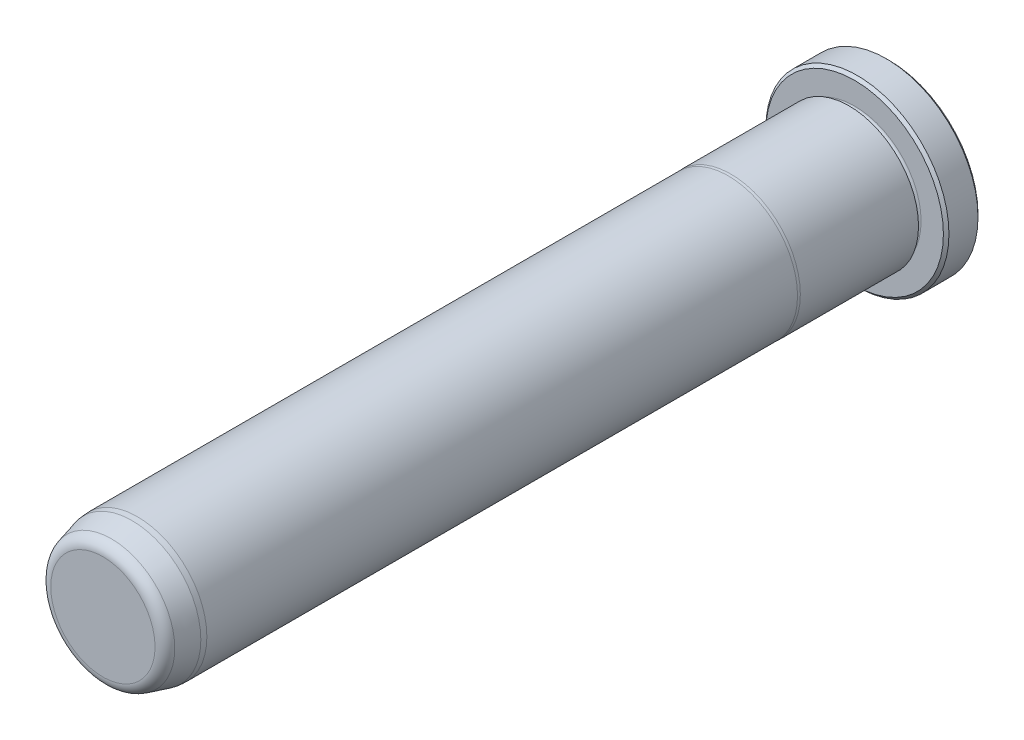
SolidWorks part; units mm, degrees
ref_plane "Front Plane" through (0, 0, 0) normal (0, 0, 1) x (1, 0, 0)
ref_plane "Top Plane" through (0, 0, 0) normal (0, 1, 0) x (1, 0, 0)
ref_plane "Right Plane" through (0, 0, 0) normal (1, 0, 0) x (0, 0, -1)
sketch "Sketch1" plane through (0, 0, 0) normal (1, 0, 0) x (0, 0, -1)
  line L0 (0, 0) -> (0, 12.573)
  line L1 (0, 12.573) -> (-4.7498, 12.573)
  line L2 (-4.7498, 12.573) -> (-4.7498, 9.1313)
  line L3 (-4.7498, 8.7503) -> (-5.5118, 8.7503) construction
  line L4 (-5.5118, 9.1313) -> (-5.5118, 9.5377)
  line L5 (-5.5118, 9.5377) -> (-21.7348, 9.5377)
  line L6 (-21.7348, 9.5377) -> (-22.098, 9.5123)
  line L7 (-22.098, 9.5123) -> (-103.1875, 9.5123)
  line L9 (-107.95, 8.3737) -> (-107.95, 0)
  line L10 (-107.95, 0) -> (0, 0)
  line L11 (0, 0) -> (13.6287, 0) construction
  line L12 (-103.1875, 9.5123) -> (-103.9495, 9.4456)
  line L13 (-103.9495, 9.4456) -> (-107.95, 8.3737)
  arc A0 (-5.5118, 9.1313) -> (-4.7498, 9.1313) centre (-5.1308, 9.1313) ccw
  dimension "D14" = 0.762
  dimension "D1" = 4.7498
  dimension "D2" = 0.762
  dimension "D3" = 25.146
  dimension "D4" = 19.0754
  dimension "D5" = 22.098
  dimension "D6" = 107.95
  dimension "D7" = 0.7874
  dimension "D8" = 4
  dimension "D9" = 19.0246
  dimension "D10" = 5
  dimension "D11" = 15
  dimension "D12" = 0.762
  dimension "D13" = 4.7625
revolve "Revolve1" add sketch "Sketch1" angle 360 about L11
fillet "Fillet6" radius 1.5875 1 edges at (8.3737, 0, 107.95)
chamfer "Chamfer1" distance 0.381 angle 45 2 edges at (12.573, 0, 0) (12.573, 0, 4.7498)
